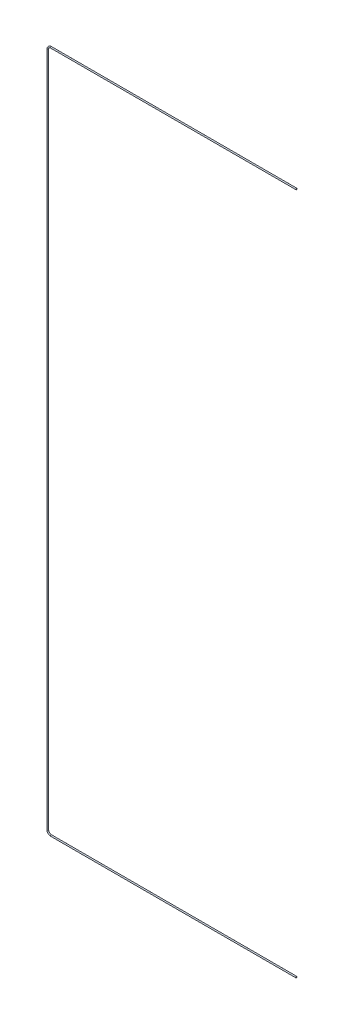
SolidWorks part; units mm, degrees
ref_plane "Front Plane" through (0, 0, 0) normal (0, 0, 1) x (1, 0, 0)
ref_plane "Top Plane" through (0, 0, 0) normal (0, 1, 0) x (1, 0, 0)
ref_plane "Right Plane" through (0, 0, 0) normal (1, 0, 0) x (0, 0, -1)
sketch3d "3DSketch1"
  line L0 (0, 0, 0) -> (-400.05, 0, 0)
  line L1 (-406.4, -6.35, 0) -> (-406.4, -1108.456, 0)
  line L2 (-400.05, -1114.806, 0) -> (0, -1114.806, 0)
  arc A0 (-406.4, -6.35, 0) -> (-400.05, 0, 0) centre (-400.05, -6.35, 0) ccw
  arc A1 (-406.4, -1108.456, 0) -> (-400.05, -1114.806, 0) centre (-400.05, -1108.456, 0) ccw
  point P6 (-406.4, 0, 0)
  point P7 (-400.05, -6.35, -6.35)
  point P10 (-406.4, -1114.806, 0)
  point P11 (-400.05, -1108.456, 6.35)
  point P15 (0, 0, 0)
  dimension "D4" = 6.35
  dimension "D1" = 406.4
  dimension "D3" = 406.4
  dimension "D2" = 1114.806
sketch "Sketch7" plane through (0, 0, 0) normal (1, 0, 0) x (0, 0, -1)
  circle A0 centre (0, -1.0262) radius 1.0262
  point P2 (0, 0)
  dimension "D1" = 2.0523
sweep "Sweep1" add profiles "Sketch7" path "3DSketch1"
